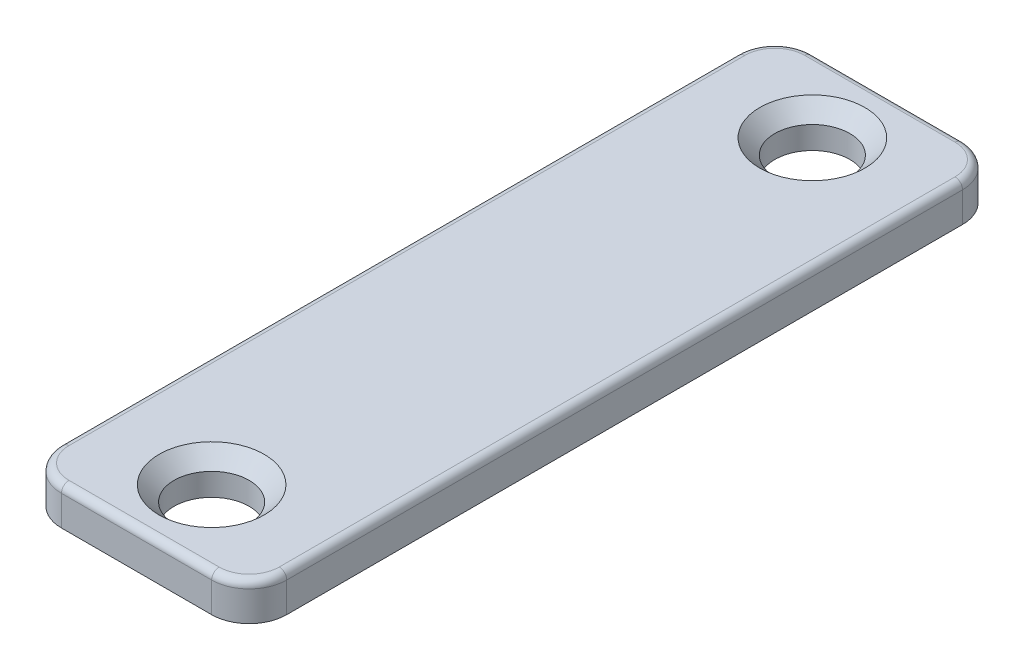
SolidWorks part; units mm, degrees
ref_plane "Front Plane" through (0, 0, 0) normal (0, 0, 1) x (1, 0, 0)
ref_plane "Top Plane" through (0, 0, 0) normal (0, 1, 0) x (1, 0, 0)
ref_plane "Right Plane" through (0, 0, 0) normal (1, 0, 0) x (0, 0, -1)
sketch "Sketch1" plane through (0, 0, 0) normal (0, 1, 0) x (1, 0, 0)
  line L1 (1, -5) -> (-1, -5)
  line L2 (1.5, -4.5) -> (1.5, 4.5)
  line L3 (1, 5) -> (-1, 5)
  line L4 (-1.5, -4.5) -> (-1.5, 4.5)
  line L5 (1.5, -5) -> (-1.5, 5) construction
  line L6 (1.5, 5) -> (-1.5, -5) construction
  circle A0 centre (0, 4) radius 0.5
  circle A1 centre (0, -4) radius 0.5
  arc A2 (1, -5) -> (1.5, -4.5) centre (1, -4.5) ccw
  arc A3 (-1, -5) -> (-1.5, -4.5) centre (-1, -4.5) cw
  arc A4 (1.5, 4.5) -> (1, 5) centre (1, 4.5) ccw
  arc A5 (-1, 5) -> (-1.5, 4.5) centre (-1, 4.5) ccw
  point P0 (0, 0)
  dimension "D5" = 1
  dimension "D6" = 1
  dimension "D7" = 0.5
  dimension "D1" = 10
  dimension "D2" = 3
  dimension "D3" = 4
  dimension "D4" = 4
extrude "Boss-Extrude1" add sketch "Sketch1" along normal blind 0.5
fillet "Fillet1" radius 0.1 8 edges at (0, 0.5, 5) (-1.3536, 0.5, 4.8536) (-1.5, 0.5, 0) (-1.3536, 0.5, -4.8536) (0, 0.5, -5) (1.3536, 0.5, -4.8536) (1.5, 0.5, 0) (1.3536, 0.5, 4.8536)
chamfer "Chamfer1" distance 0.2 angle 45 2 edges at (0, 0.5, 4.5) (0, 0.5, -3.5)
